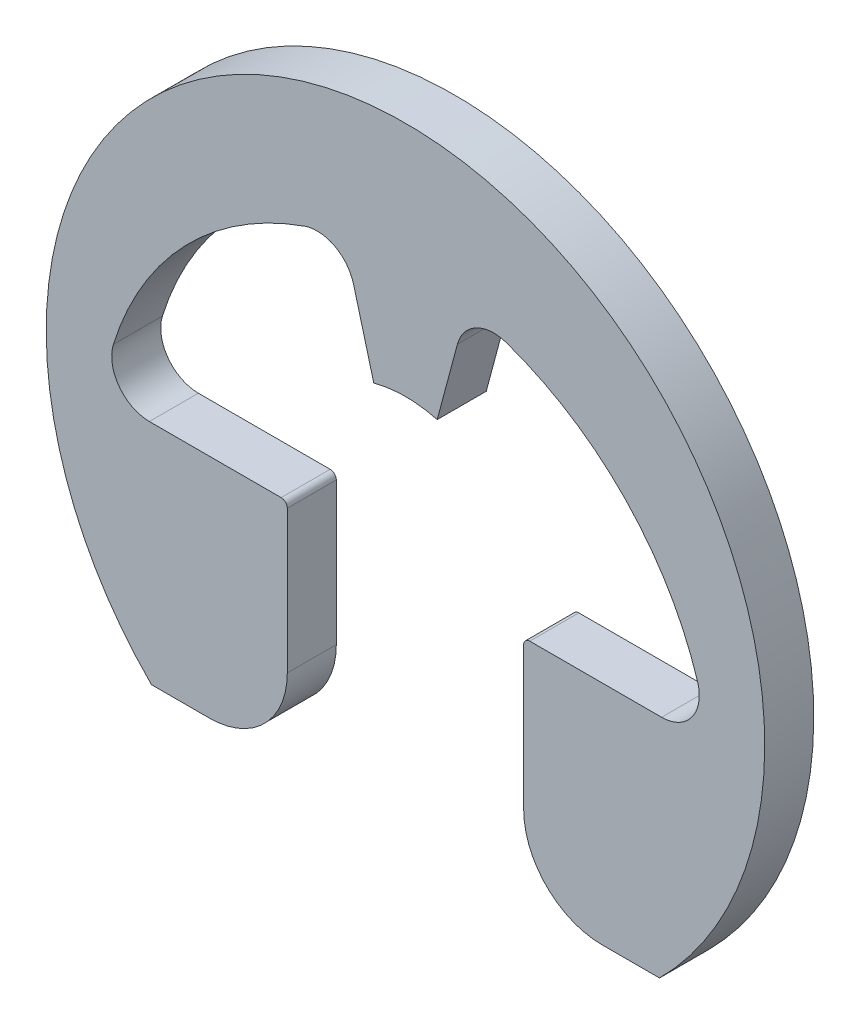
SolidWorks part; units mm, degrees
ref_plane "Plane1" through (0, 0, 0) normal (0, 0, 1) x (1, 0, 0)
ref_plane "Plane2" through (0, 0, 0) normal (0, 1, 0) x (1, 0, 0)
ref_plane "Plane3" through (0, 0, 0) normal (1, 0, 0) x (0, 0, -1)
other "Configuration Table"
sketch "Clipboard" plane through (0, 0, 0) normal (0, 0, 1) x (1, 0, 0)
  line L0 (0, 0) -> (1.5, 0)
  circle A0 centre (0, 0) radius 1.45
  circle A1 centre (0, 0) radius 4.25
sketch "BodySke" plane through (0, 0, 0) normal (0, 0, 1) x (1, 0, 0)
  line L0 (-3.6466, 0) -> (3.6466, 0) construction
  line L1 (0, 0) -> (0, 2.8966) construction
  line L2 (0, 0) -> (0.1962, 0.7323) construction
  line L3 (0, 0) -> (4.2467, -1.1379) construction
  line L4 (0, 0) -> (-0.1962, 0.7323) construction
  line L5 (0, 0) -> (-4.2467, -1.1379) construction
  line L6 (0, 0) -> (3.1088, -3.1088) construction
  line L7 (0, 0) -> (-3.1088, -3.1088) construction
  line L8 (3.1088, -3.1088) -> (2.4022, -3.1088)
  line L9 (-2.4022, -3.1088) -> (-3.1088, -3.1088)
  line L10 (1.5213, -0.3326) -> (3.1346, -0.3326)
  line L11 (0.6356, 2.372) -> (0.3882, 1.4489)
  line L12 (-0.6356, 2.372) -> (-0.3882, 1.4489)
  line L13 (1.4463, -0.4076) -> (1.4463, -2.153)
  line L14 (-1.5213, -0.3326) -> (-3.1346, -0.3326)
  line L15 (-1.4463, -0.4076) -> (-1.4463, -2.153)
  circle A0 centre (0, 0) radius 1.5 construction
  arc A1 (3.6466, 0) -> (-3.6466, 0) centre (0, -0.8471) ccw construction
  arc A2 (3.1088, -3.1088) -> (-3.1088, -3.1088) centre (0, 0) ccw
  arc A3 (1.5213, -0.3326) -> (1.4463, -0.4076) centre (1.5213, -0.4076) ccw
  arc A4 (-1.4463, -0.4076) -> (-1.5213, -0.3326) centre (-1.5213, -0.4076) ccw
  arc A5 (-3.5746, 0.2651) -> (-1.2324, 2.6879) centre (0, -0.8471) cw
  arc A6 (-0.3882, 1.4489) -> (0.3882, 1.4489) centre (0, 0) cw
  arc A7 (1.2324, 2.6879) -> (3.5746, 0.2651) centre (0, -0.8471) cw
  arc A8 (3.1346, -0.3326) -> (3.5746, 0.2651) centre (3.1346, 0.1282) ccw
  arc A9 (1.2324, 2.6879) -> (0.6356, 2.372) centre (1.0807, 2.2527) ccw
  arc A10 (-0.6356, 2.372) -> (-1.2324, 2.6879) centre (-1.0807, 2.2527) ccw
  arc A11 (-3.5746, 0.2651) -> (-3.1346, -0.3326) centre (-3.1346, 0.1282) ccw
  arc A12 (1.4463, -2.153) -> (2.4022, -3.1088) centre (2.4022, -2.153) ccw
  arc A13 (-2.4022, -3.1088) -> (-1.4463, -2.153) centre (-2.4022, -2.153) ccw
extrude "Body" add sketch "BodySke" against normal blind 0.6
equation "' \"FreeID@Clipboard\" = 2.9"
equation "' \"Thickness@Body\" = 0.6"
equation "' \"GrooveDia@BodySke\" = 3.0"
equation "' \"FreeOD@Clipboard\" = 8.5"
equation "' \"LargeSection@Clipboard\" = 1.5"
equation "' \"FreeID@Clipboard\" = 11.5"
equation "' \"Thickness@Body\" = 1.1"
equation "' \"GrooveDia@BodySke\" = 11.8"
equation "' \"FreeOD@Clipboard\" = 23.2"
equation "' \"LargeSection@Clipboard\" = 3.9"
equation "\"OutsideDia@BodySke\" = ( \"GrooveDia@BodySke\"  /  \"FreeID@Clipboard\" )  * \"FreeOD@Clipboard\""
equation "\"CavityHeight@BodySke\" = \"OutsideDia@BodySke\"  /  2 - \"LargeSection@Clipboard\""
equation "\"CavityWidth@BodySke\" = \"OutsideDia@BodySke\" -  \"LargeSection@Clipboard\""
equation "\"CavityFilletRad@BodySke\" =  (\"CavityHeight@BodySke\" * 2 - \"GrooveDia@BodySke\") / 2 * 0.33"
equation "\"InnerTipRad@BodySke\" = \"GrooveDia@BodySke\" * 0.025"
equation "\"OuterTipRadius@BodySke\" =  (\"OutsideDia@BodySke\" - \"GrooveDia@BodySke\") / 2 * 0.33"
